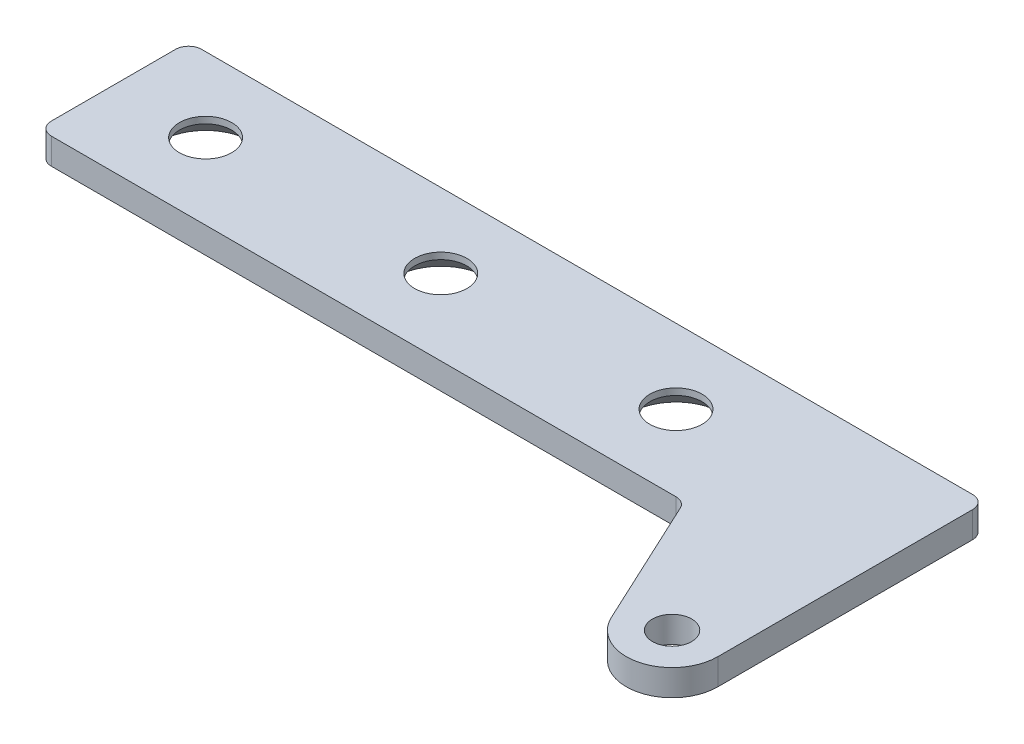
SolidWorks part; units mm, degrees
other "<_蝶番A-2>-<ｶｯﾄ - 押し出し1>"
ref_plane "正面" through (0, 0, 0) normal (0, 0, 1) x (1, 0, 0)
ref_plane "平面" through (0, 0, 0) normal (0, 1, 0) x (1, 0, 0)
ref_plane "右側面" through (0, 0, 0) normal (1, 0, 0) x (0, 0, -1)
mirrored part "_蝶番A-2_ﾐﾗｰ ｺﾋﾟｰ"
